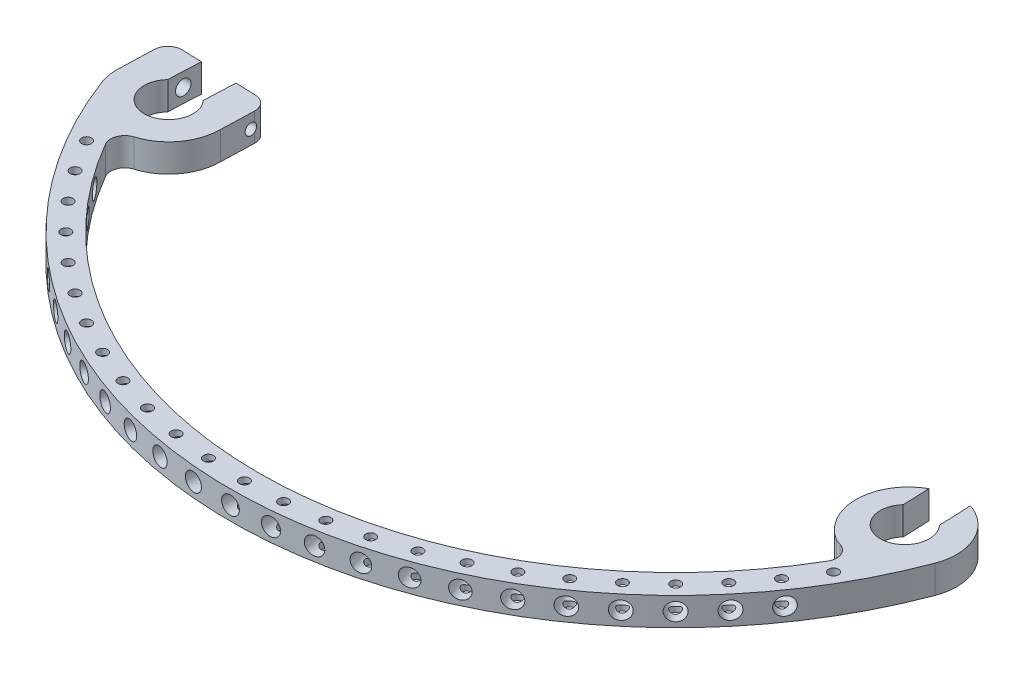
SolidWorks part; units mm, degrees
ref_plane "Front Plane" through (0, 0, 0) normal (0, 0, 1) x (1, 0, 0)
ref_plane "Top Plane" through (0, 0, 0) normal (0, 1, 0) x (1, 0, 0)
ref_plane "Right Plane" through (0, 0, 0) normal (1, 0, 0) x (0, 0, -1)
sketch "Sketch1" plane through (0, 0, 0) normal (0, 1, 0) x (1, 0, 0)
  line L0 (-183.3366, -40.4084) -> (-174.3418, -40.7055)
  line L1 (-189.8928, -46.5453) -> (-190.4365, -63.0046)
  line L2 (-142.954, -48.0958) -> (-143.4465, -63.0046)
  line L3 (-158.0858, -41.2425) -> (-149.0909, -41.5396)
  circle A0 centre (166.9415, -63.0046) radius 23.495 construction
  circle A1 centre (-166.9415, -63.0046) radius 23.495 construction
  arc A2 (158.7275, -55.5201) -> (174.9835, -55.3356) centre (166.9415, -63.0046) ccw
  arc A3 (-188.9231, -71.3006) -> (188.9231, -71.3006) centre (0, 0) ccw
  arc A4 (-174.9835, -55.3356) -> (-158.7275, -55.5201) centre (-166.9415, -63.0046) ccw
  arc A5 (158.7275, -55.5201) -> (158.0858, -41.2425) centre (-166.9415, -63.0046) ccw
  arc A6 (174.9835, -55.3356) -> (174.3418, -40.7055) centre (-166.9415, -63.0046) ccw
  arc A7 (-158.7275, -55.5201) -> (-158.0858, -41.2425) centre (166.9415, -63.0046) cw
  arc A8 (-174.9835, -55.3356) -> (-174.3418, -40.7055) centre (166.9415, -63.0046) cw
  arc A9 (-163.7616, -94.8162) -> (163.7616, -94.8162) centre (0, 0) ccw
  arc A10 (188.9231, -71.3006) -> (174.3418, -40.7055) centre (166.9415, -63.0046) ccw
  arc A11 (158.0858, -41.2425) -> (160.1409, -85.4939) centre (166.9415, -63.0046) ccw
  circle A12 centre (-169.3772, -97.7901) radius 2.2479
  arc A13 (160.1409, -85.4939) -> (163.7616, -94.8162) centre (158.3029, -91.5721) cw
  arc A14 (-143.4465, -63.0046) -> (-160.1409, -85.4939) centre (-166.9415, -63.0046) cw
  arc A15 (-160.1409, -85.4939) -> (-163.7616, -94.8162) centre (-158.3029, -91.5721) ccw
  arc A16 (-149.0909, -41.5396) -> (-142.954, -48.0958) centre (-149.3006, -47.8862) cw
  arc A17 (-183.3366, -40.4084) -> (-189.8928, -46.5453) centre (-183.5463, -46.7549) ccw
  arc A18 (-190.4365, -63.0046) -> (-188.9231, -71.3006) centre (-166.9415, -63.0046) ccw
  arc A19 (-193.5816, -27.8872) -> (193.4924, -28.4997) centre (0, 0) ccw construction
  circle A20 centre (-160.2097, -112.1802) radius 2.2479
  circle A21 centre (-149.8229, -125.7165) radius 2.2479
  circle A22 centre (-138.2959, -138.296) radius 2.2479
  circle A23 centre (-125.7164, -149.823) radius 2.2479
  circle A24 centre (-112.18, -160.2098) radius 2.2479
  circle A25 centre (-97.79, -169.3773) radius 2.2479
  circle A26 centre (-82.6557, -177.2557) radius 2.2479
  circle A27 centre (-66.8923, -183.7851) radius 2.2479
  circle A28 centre (-50.6198, -188.9158) radius 2.2479
  circle A29 centre (-33.9621, -192.6088) radius 2.2479
  circle A30 centre (-17.0459, -194.8358) radius 2.2479
  circle A31 centre (0, -195.5801) radius 2.2479
  circle A32 centre (17.0459, -194.8358) radius 2.2479
  circle A33 centre (33.9621, -192.6088) radius 2.2479
  circle A34 centre (50.6198, -188.9158) radius 2.2479
  circle A35 centre (66.8923, -183.7851) radius 2.2479
  circle A36 centre (82.6557, -177.2557) radius 2.2479
  circle A37 centre (97.79, -169.3773) radius 2.2479
  circle A38 centre (112.18, -160.2098) radius 2.2479
  circle A39 centre (125.7164, -149.823) radius 2.2479
  circle A40 centre (138.2959, -138.296) radius 2.2479
  circle A41 centre (149.8229, -125.7165) radius 2.2479
  circle A42 centre (160.2097, -112.1802) radius 2.2479
  circle A43 centre (169.3772, -97.7901) radius 2.2479
  circle A44 centre (0, 0) radius 201.93 construction
  point P1 (-166.9415, -63.0046)
  point P2 (166.9415, -63.0046)
  point P25 (168.6687, -86.4361)
  point P32 (-168.6687, -86.4361)
  dimension "D1" = 333.883
  dimension "D2" = 46.99
  dimension "D3" = 22.225
  dimension "D4" = 325.755
  dimension "D5" = 201.93
  dimension "D6" = 325.755
  dimension "D7" = 342.011
  dimension "D9" = 12.7
  dimension "D10" = 6.35
  dimension "D11" = 6.35
  dimension "D13" = 10.0008
  dimension "D14" = 195.58
  dimension "D15" = 4.4958
  dimension "D12" = 10.0008
  dimension "D16" = 169.3772
  dimension "D8" = 342.011
  dimension "D17" = 46.99
  dimension "D18" = 403.86
extrude "Extrude1" add sketch "Sketch1" along normal mid plane 12.7
ref_plane "Plane1" through (0, 0, 201.93) normal (0, 0, 1) x (1, 0, 0)
sketch "Sketch2" plane through (0, 0, 201.93) normal (0, 0, 1) x (1, 0, 0)
  circle A0 centre (0, 0) radius 4.0132
  dimension "D1" = 8.0264
extrude ".316 Dia. Mntg Holes" cut sketch "Sketch2" against normal up to next
pattern_circular ".316 Dia Mntg Holes" count 12 every 5 about axis through (0, 6.35, 0) along (0, -1, 0) of ".316 Dia. Mntg Holes"
pattern_circular ".316 Dia Mtng Holes" count 12 every 5 about axis through (0, 6.35, 0) along (0, -1, 0) of ".316 Dia. Mntg Holes"
hole_wizard "1/4-20 Tapped Hole1" positions "3DSketch1" profile "Sketch3" tap size "1/4-20" standard "Ansi Inch"
sketch3d "3DSketch1"
  point P0 (-189.9431, 0, 48.0685)
  dimension "D1" = 6.35
  dimension "D2" = 7.874
sketch "Sketch3" plane through (-189.9431, 0, 48.0685) normal (0, 1, 0) x (-0.033, 0, 0.9995)
  line L0 (0, 0) -> (0, 48.9904)
  line L1 (0, 48.9904) -> (2.5527, 47.4566)
  line L2 (2.5527, 47.4566) -> (2.5527, 0)
  line L5 (2.5527, 0) -> (0, 0)
  line L10 (0, 48.9904) -> (-2.5527, 47.4566) construction
  line L11 (0, -6.35) -> (0, 107.95) construction
  dimension "Tap Drill Dia." = 5.1054
  dimension "Tap Drill Depth" = 47.4566
  dimension "Drill Angle" = 118
hole_wizard "CBORE for 1/4 Socket Head Cap Screw1" positions "3DSketch2" profile "Sketch6" counterbore size "1/4" standard "Ansi Inch"
sketch3d "3DSketch2"
  point P0 (-189.9431, 0, 48.0685)
  dimension "D1" = 7.874
  dimension "D2" = 6.35
sketch "Sketch6" plane through (-189.9431, 0, 48.0685) normal (0, 1, 0) x (-0.033, 0, 0.9995)
  line L0 (0, 0) -> (0, 27.4298)
  line L1 (0, 27.4298) -> (3.3782, 25.4)
  line L2 (3.3782, 25.4) -> (3.3782, 6.35)
  line L3 (3.3782, 6.35) -> (5.5562, 6.35)
  line L5 (5.5562, 6.35) -> (5.5562, 0.635)
  line L6 (5.5562, 0.635) -> (6.1912, 0)
  line L7 (6.1912, 0) -> (0, 0)
  line L8 (-5.5562, 0.635) -> (-6.1912, 0) construction
  line L10 (0, 27.4298) -> (-3.3782, 25.4) construction
  line L11 (0, -6.35) -> (0, 107.95) construction
  dimension "Hole Dia." = 6.7564
  dimension "Hole Depth" = 25.4
  dimension "C'Bore Dia." = 11.1125
  dimension "C'Bore Depth" = 6.35
  dimension "Near C'Sink Dia." = 12.3825
  dimension "Near C'Sink Angle" = 90
  dimension "Drill Angle" = 118
sketch "Sketch7" plane through (0, -6.35, 0) normal (0, -1, 0) x (1, 0, 0)
  line L0 (169.7472, 64.1955) -> (138.2959, 138.296) construction
  line L1 (169.7472, 64.1955) -> (146.1675, 54.1873) construction
  line L3 (160.4684, 86.0568) -> (179.0261, 42.3342) construction
  line L4 (160.4684, 86.0568) -> (159.2775, 88.8626)
  line L5 (179.0261, 42.3342) -> (180.217, 39.5284)
  line L7 (162.1512, 89.8934) -> (182.9547, 40.8794) construction
  arc A0 (160.4684, 86.0568) -> (179.0261, 42.3342) centre (169.7472, 64.1955) ccw
  arc A1 (174.9835, 55.3356) -> (158.7275, 55.5201) centre (166.9415, 63.0046) ccw construction
  arc A2 (159.2775, 88.8626) -> (180.217, 39.5284) centre (169.7472, 64.1955) ccw
  arc A3 (162.1512, 89.8934) -> (182.9547, 40.8794) centre (169.7472, 64.1955) ccw construction
  dimension "D1" = 47.498
  dimension "D2" = 3.048
  dimension "D3" = 3.048
extrude "Extrude2" cut sketch "Sketch7" against normal through all
